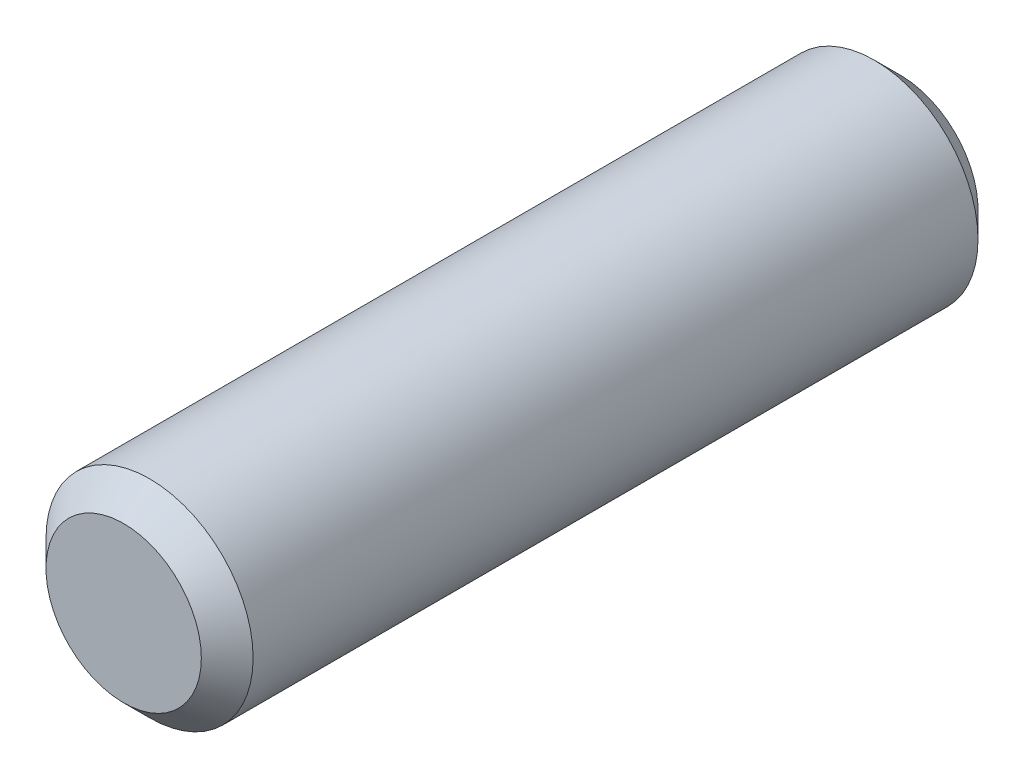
SolidWorks part; units mm, degrees
ref_plane "Plan de face" through (0, 0, 0) normal (0, 0, 1) x (1, 0, 0)
ref_plane "Plan de dessus" through (0, 0, 0) normal (0, 1, 0) x (1, 0, 0)
ref_plane "Plan de droite" through (0, 0, 0) normal (1, 0, 0) x (0, 0, -1)
sketch "Esquisse1" plane through (0, 0, 0) normal (1, 0, 0) x (0, 0, -1)
  line L0 (0, 0) -> (0, 4)
  line L1 (0, 4) -> (30, 4)
  line L2 (30, 4) -> (30, 0)
  line L3 (30, 0) -> (0, 0)
  line L4 (0, 0) -> (-2.3896, 0) construction
  dimension "D1" = 8
  dimension "D2" = 30
revolve "Révolution1" add sketch "Esquisse1" angle 360 about L4
chamfer "Chanfrein1" distance 1 angle 45 2 edges at (-4, 0, -30) (-4, 0, 0)
